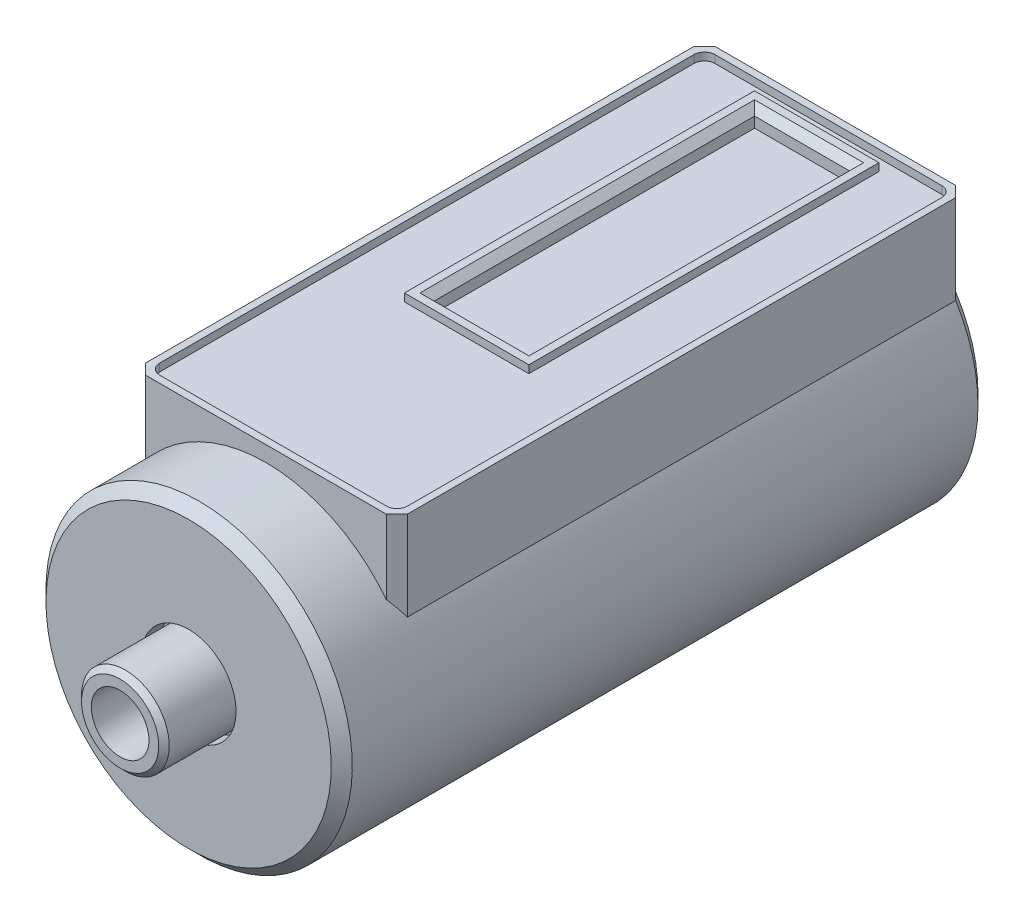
SolidWorks part; units mm, degrees
ref_plane "Front" through (0, 0, 0) normal (0, 0, 1) x (1, 0, 0)
ref_plane "Top" through (0, 0, 0) normal (0, 1, 0) x (1, 0, 0)
ref_plane "Right" through (0, 0, 0) normal (1, 0, 0) x (0, 0, -1)
sketch "Sketch2" plane through (0, 0, 0) normal (1, 0, 0) x (0, 0, -1)
  line L0 (64.31, 0) -> (64.31, 2.79)
  line L1 (64.69, 3.17) -> (70.53, 3.17)
  line L2 (69.26, 3.43) -> (69.26, 10.31)
  line L3 (70.02, 11.07) -> (116, 11.07)
  line L4 (116, 11.07) -> (116, 0)
  line L5 (116, 0) -> (64.31, 0)
  line L6 (69.26, 3.43) -> (70.53, 3.43)
  line L7 (70.53, 3.43) -> (70.53, 3.17)
  line L8 (64.31, 2.79) -> (64.69, 3.17)
  line L9 (69.26, 10.31) -> (70.02, 11.07)
  dimension "D1" = 51.69
  dimension "D2" = 3.17
  dimension "D3" = 11.07
  dimension "D4" = 4.95
  dimension "D5" = 1.27
  dimension "D6" = 3.43
  dimension "D7" = 2.79
  dimension "D8" = 0.38
  dimension "D9" = 0.76
  dimension "D10" = 10.31
  dimension "D11" = 116
revolve "Revolve1" add sketch "Sketch2" angle 360 about L5
sketch "Sketch3" plane through (0, 0, 0) normal (0, 1, 0) x (1, 0, 0)
  line L0 (11.07, 116) -> (-11.07, 116) construction
  line L1 (-9.46, 116) -> (9.46, 116)
  line L2 (-9.46, 116) -> (-9.46, 75.61)
  line L3 (-8.7, 74.85) -> (8.7, 74.85)
  line L4 (9.46, 116) -> (9.46, 75.61)
  line L5 (-9.46, 75.61) -> (-8.7, 74.85)
  line L6 (9.46, 75.61) -> (8.7, 74.85)
  point P1 (9.46, 74.85)
  point P2 (-9.46, 74.85)
  point P6 (0, 74.85)
  dimension "D1" = 41.15
  dimension "D2" = 18.92
extrude "Extrude1" add sketch "Sketch3" along normal blind 12.19
chamfer "Chamfer1" distance 0.76 angle 45 3 edges at (-9.46, 8.9696, -116) (0, -11.07, -116) (9.46, 8.9696, -116)
sketch "Sketch4" plane through (0, 12.19, 0) normal (0, 1, 0) x (1, 0, 0)
  line L0 (-8.7, 74.85) -> (8.7, 74.85) construction
  line L1 (-8.19, 115.49) -> (8.2, 115.49)
  line L2 (-8.95, 114.73) -> (-8.95, 76.12)
  line L3 (-8.19, 75.36) -> (8.2, 75.36)
  line L4 (8.96, 114.73) -> (8.96, 76.12)
  line L5 (-9.46, 75.61) -> (-9.46, 115.24) construction
  line L7 (-4.49, 114.65) -> (4.5, 114.65)
  line L8 (-4.49, 114.65) -> (-4.49, 89.35)
  line L9 (-4.49, 89.35) -> (4.5, 89.35)
  line L10 (4.5, 114.65) -> (4.5, 89.35)
  arc A0 (-8.95, 114.73) -> (-8.19, 115.49) centre (-8.19, 114.73) cw
  arc A1 (8.96, 114.73) -> (8.2, 115.49) centre (8.2, 114.73) ccw
  arc A2 (8.96, 76.12) -> (8.2, 75.36) centre (8.2, 76.12) cw
  arc A3 (-8.95, 76.12) -> (-8.19, 75.36) centre (-8.19, 76.12) ccw
  dimension "D5" = 0.76
  dimension "D1" = 17.91
  dimension "D2" = 40.13
  dimension "D3" = 0.51
  dimension "D4" = 0.51
  dimension "D6" = 0.84
  dimension "D7" = 4.46
  dimension "D8" = 4.46
  dimension "D9" = 25.3
extrude "Cut-Extrude1" cut sketch "Sketch4" against normal blind 0.56
sketch "Sketch5" plane through (0, 12.19, 0) normal (0, 1, 0) x (1, 0, 0)
  line L1 (-3.42, 113.58) -> (3.44, 113.58)
  line L2 (-3.42, 113.58) -> (-3.42, 90.42)
  line L3 (-3.42, 90.42) -> (3.44, 90.42)
  line L4 (3.44, 113.58) -> (3.44, 90.42)
  line L6 (4.5, 114.65) -> (-4.49, 114.65) construction
  line L7 (-4.49, 114.65) -> (-4.49, 89.35) construction
  point P4 (0.005, 114.65)
  dimension "D1" = 6.86
  dimension "D2" = 23.16
  dimension "D3" = 1.07
  dimension "D4" = 1.07
extrude "Cut-Extrude2" cut sketch "Sketch5" against normal blind 1.27
chamfer "Chamfer2" distance 0.51 angle 45 4 edges at (0.01, 12.19, -90.42) (3.44, 12.19, -102) (-3.42, 12.19, -102) (0.01, 12.19, -113.58)
hole_wizard "Hole1" positions "Sketch7" profile "Sketch6" legacy
sketch "Sketch7" plane through (0, 0, -64.31) normal (0, 0, 1) x (1, 0, 0)
  circle A0 centre (0, 0) radius 3.17 construction
  point P0 (0, 0)
sketch "Sketch6" plane through (0, 0, -64.31) normal (1, 0, 0) x (0, -1, 0)
  line L0 (0, 0) -> (0, 7.6015)
  line L1 (0, 7.6015) -> (2.0828, 6.35)
  line L2 (2.0828, 6.35) -> (2.0828, 0)
  line L4 (2.0828, 0) -> (0, 0)
  line L6 (0, 7.6015) -> (-2.0828, 6.35) construction
  line L7 (0, -4.2442) -> (0, 117.3081) construction
  dimension "Diameter" = 4.1656
  dimension "Depth" = 6.35
  dimension "Drill Angle" = 118
